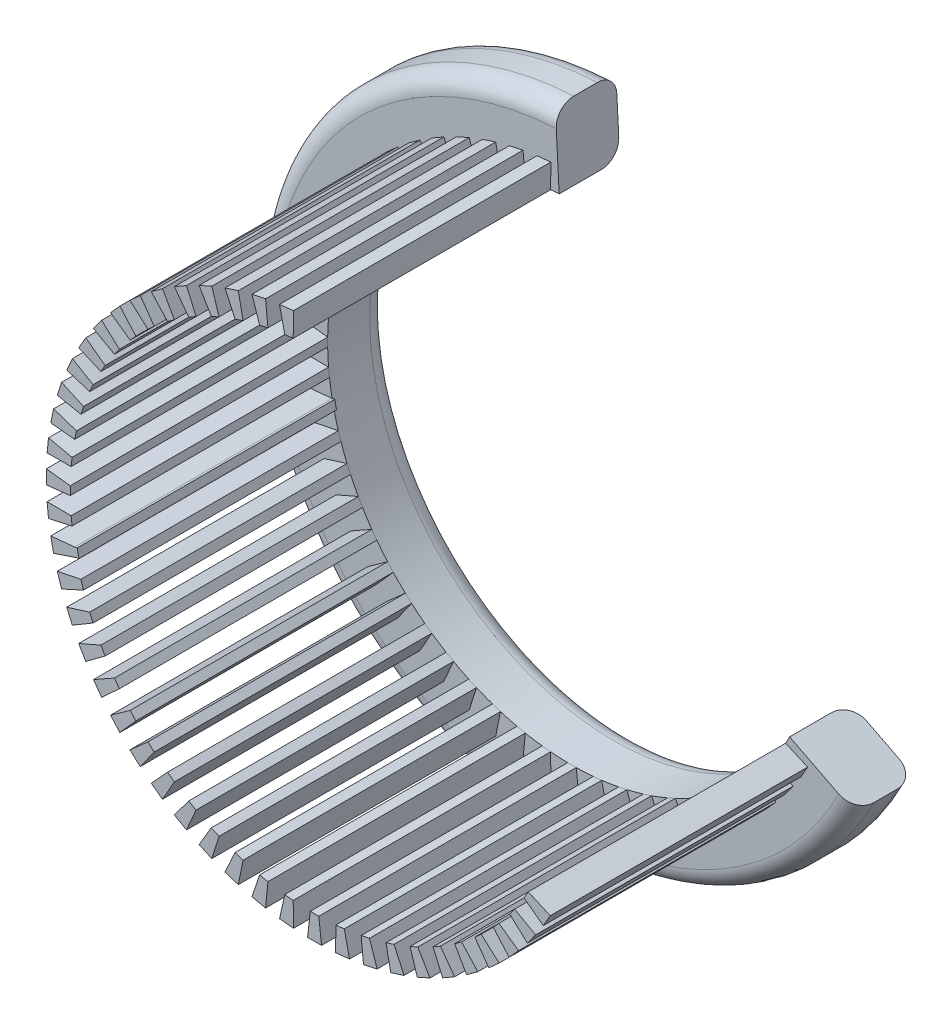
SolidWorks part; units mm, degrees
ref_plane "Přední rovina" through (0, 0, 0) normal (0, 0, 1) x (1, 0, 0)
ref_plane "Horní rovina" through (0, 0, 0) normal (0, 1, 0) x (1, 0, 0)
ref_plane "Pravá rovina" through (0, 0, 0) normal (1, 0, 0) x (0, 0, -1)
sketch "Skica1" plane through (0, 0, 0) normal (0, 0, 1) x (1, 0, 0)
  line L0 (0.0049, 148.7514) -> (0.0049, -162.0328) construction
  line L1 (-203.1858, -0.0001) -> (251.9227, -0.0001) construction
  line L2 (1.4, 79.8) -> (1.4, 78.4875)
  line L3 (0.0049, 78.3462) -> (0.0049, 88.5562)
  line L4 (-2.2951, 88.5562) -> (2.3049, 88.5562)
  line L5 (0.0049, 88.5562) -> (0.0049, 80.6562)
  line L6 (-1.3951, 80.6562) -> (1.4049, 80.6562)
  line L7 (0.0049, 80.6562) -> (0.0049, 80.0562)
  line L8 (7.0435, 80.3607) -> (9.8281, 80.068)
  line L9 (1.4, 79.8) -> (1.4049, 80.6562)
  line L10 (2.3049, 88.5562) -> (1.4049, 80.6562)
  line L11 (-1.3902, 79.8) -> (-1.3951, 80.6562)
  line L12 (-2.2951, 88.5562) -> (-1.3951, 80.6562)
  line L13 (6.9742, 88.3115) -> (7.0435, 80.3607)
  line L14 (6.9742, 88.3115) -> (11.549, 87.8307)
  line L15 (11.549, 87.8307) -> (9.8281, 80.068)
  line L16 (6.9588, 79.5087) -> (7.0435, 80.3607)
  line L17 (15.4049, 79.1848) -> (18.1437, 78.6026)
  line L18 (9.7337, 79.217) -> (9.8281, 80.068)
  line L19 (16.1671, 87.0993) -> (15.4049, 79.1848)
  line L20 (16.1671, 87.0993) -> (20.6665, 86.1429)
  line L21 (20.6665, 86.1429) -> (18.1437, 78.6026)
  line L22 (15.2317, 78.3462) -> (15.4049, 79.1848)
  line L23 (23.5976, 77.1413) -> (26.2606, 76.276)
  line L24 (17.9609, 77.7661) -> (18.1437, 78.6026)
  line L25 (25.1829, 84.9327) -> (23.5976, 77.1413)
  line L26 (25.1829, 84.9327) -> (29.5577, 83.5112)
  line L27 (29.5577, 83.5112) -> (26.2606, 76.276)
  line L28 (23.3377, 76.3254) -> (23.5976, 77.1413)
  line L29 (31.5318, 74.2526) -> (34.0897, 73.1137)
  line L30 (25.9913, 75.4632) -> (26.2606, 76.276)
  line L31 (33.9229, 81.8356) -> (31.5318, 74.2526)
  line L32 (33.9229, 81.8356) -> (38.1252, 79.9646)
  line L33 (38.1252, 79.9646) -> (34.0897, 73.1137)
  line L34 (31.188, 73.4684) -> (31.5318, 74.2526)
  line L35 (39.1206, 70.5503) -> (41.5455, 69.1503)
  line L36 (33.737, 72.3335) -> (34.0897, 73.1137)
  line L37 (42.2912, 77.8419) -> (39.1206, 70.5503)
  line L38 (42.2912, 77.8419) -> (46.2749, 75.5419)
  line L39 (46.2749, 75.5419) -> (41.5455, 69.1503)
  line L40 (38.6968, 69.8064) -> (39.1206, 70.5503)
  line L41 (46.2809, 66.0751) -> (48.5461, 64.4293)
  line L42 (41.1131, 68.4113) -> (41.5455, 69.1503)
  line L43 (50.1963, 72.9954) -> (46.2809, 66.0751)
  line L44 (50.1963, 72.9954) -> (53.9177, 70.2916)
  line L45 (53.9177, 70.2916) -> (48.5461, 64.4293)
  line L46 (45.7816, 65.3796) -> (46.2809, 66.0751)
  line L47 (52.9341, 60.876) -> (55.0149, 59.0025)
  line L48 (48.0389, 63.7395) -> (48.5461, 64.4293)
  line L49 (57.5514, 67.3491) -> (52.9341, 60.876)
  line L50 (57.5514, 67.3491) -> (60.9699, 64.2711)
  line L51 (60.9699, 64.2711) -> (55.0149, 59.0025)
  line L52 (52.3648, 60.2364) -> (52.9341, 60.876)
  line L53 (59.0074, 55.0099) -> (60.881, 52.9291)
  line L54 (54.4383, 58.3694) -> (55.0149, 59.0025)
  line L55 (64.2761, 60.9649) -> (59.0074, 55.0099)
  line L56 (64.2761, 60.9649) -> (67.3541, 57.5464)
  line L57 (67.3541, 57.5464) -> (60.881, 52.9291)
  line L58 (58.3744, 54.4334) -> (59.0074, 55.0099)
  line L59 (64.4343, 48.5411) -> (66.0801, 46.2759)
  line L60 (60.2414, 52.3598) -> (60.881, 52.9291)
  line L61 (70.2966, 53.9128) -> (64.4343, 48.5411)
  line L62 (70.2966, 53.9128) -> (73.0004, 50.1913)
  line L63 (73.0004, 50.1913) -> (66.0801, 46.2759)
  line L64 (63.7445, 48.0339) -> (64.4343, 48.5411)
  line L65 (69.1553, 41.5405) -> (70.5553, 39.1156)
  line L66 (65.3845, 45.7766) -> (66.0801, 46.2759)
  line L67 (75.5469, 46.2699) -> (69.1553, 41.5405)
  line L68 (75.5469, 46.2699) -> (77.8469, 42.2862)
  line L69 (77.8469, 42.2862) -> (70.5553, 39.1156)
  line L70 (68.4163, 41.1081) -> (69.1553, 41.5405)
  line L71 (73.1187, 34.0848) -> (74.2576, 31.5268)
  line L72 (69.8114, 38.6918) -> (70.5553, 39.1156)
  line L73 (79.9696, 38.1202) -> (73.1187, 34.0848)
  line L74 (79.9696, 38.1202) -> (81.8406, 33.9179)
  line L75 (81.8406, 33.9179) -> (74.2576, 31.5268)
  line L76 (72.3385, 33.732) -> (73.1187, 34.0848)
  line L77 (76.281, 26.2556) -> (77.1462, 23.5926)
  line L78 (73.4733, 31.183) -> (74.2576, 31.5268)
  line L79 (83.5162, 29.5528) -> (76.281, 26.2556)
  line L80 (83.5162, 29.5528) -> (84.9377, 25.1779)
  line L81 (84.9377, 25.1779) -> (77.1462, 23.5926)
  line L82 (75.4682, 25.9863) -> (76.281, 26.2556)
  line L83 (78.6076, 18.1387) -> (79.1898, 15.3999)
  line L84 (76.3304, 23.3327) -> (77.1462, 23.5926)
  line L85 (86.1479, 20.6615) -> (78.6076, 18.1387)
  line L86 (86.1479, 20.6615) -> (87.1043, 16.1621)
  line L87 (87.1043, 16.1621) -> (79.1898, 15.3999)
  line L88 (77.7711, 17.9559) -> (78.6076, 18.1387)
  line L89 (80.073, 9.8231) -> (80.3657, 7.0385)
  line L90 (78.3512, 15.2267) -> (79.1898, 15.3999)
  line L91 (87.8357, 11.544) -> (80.073, 9.8231)
  line L92 (87.8357, 11.544) -> (88.3165, 6.9692)
  line L93 (88.3165, 6.9692) -> (80.3657, 7.0385)
  line L94 (79.222, 9.7287) -> (80.073, 9.8231)
  line L95 (80.6612, 1.3999) -> (80.6612, -1.4001)
  line L96 (79.5137, 6.9538) -> (80.3657, 7.0385)
  line L97 (88.5612, 2.2999) -> (80.6612, 1.3999)
  line L98 (88.5612, 2.2999) -> (88.5612, -2.3001)
  line L99 (88.5612, -2.3001) -> (80.6612, -1.4001)
  line L100 (79.805, 1.395) -> (80.6612, 1.3999)
  line L101 (80.3657, -7.0386) -> (80.073, -9.8233)
  line L102 (79.805, -1.3952) -> (80.6612, -1.4001)
  line L103 (88.3165, -6.9693) -> (80.3657, -7.0386)
  line L104 (88.3165, -6.9693) -> (87.8357, -11.5441)
  line L105 (87.8357, -11.5441) -> (80.073, -9.8233)
  line L106 (79.5137, -6.954) -> (80.3657, -7.0386)
  line L107 (79.1898, -15.4001) -> (78.6076, -18.1389)
  line L108 (79.222, -9.7289) -> (80.073, -9.8233)
  line L109 (87.1043, -16.1622) -> (79.1898, -15.4001)
  line L110 (87.1043, -16.1622) -> (86.1479, -20.6617)
  line L111 (86.1479, -20.6617) -> (78.6076, -18.1389)
  line L112 (78.3512, -15.2268) -> (79.1898, -15.4001)
  line L113 (77.1462, -23.5928) -> (76.281, -26.2557)
  line L114 (77.7711, -17.9561) -> (78.6076, -18.1389)
  line L115 (84.9377, -25.1781) -> (77.1462, -23.5928)
  line L116 (84.9377, -25.1781) -> (83.5162, -29.5529)
  line L117 (83.5162, -29.5529) -> (76.281, -26.2557)
  line L118 (76.3304, -23.3329) -> (77.1462, -23.5928)
  line L119 (74.2576, -31.527) -> (73.1187, -34.0849)
  line L120 (75.4682, -25.9865) -> (76.281, -26.2557)
  line L121 (81.8406, -33.918) -> (74.2576, -31.527)
  line L122 (81.8406, -33.918) -> (79.9696, -38.1203)
  line L123 (79.9696, -38.1203) -> (73.1187, -34.0849)
  line L124 (73.4733, -31.1832) -> (74.2576, -31.527)
  line L125 (70.5553, -39.1158) -> (69.1553, -41.5407)
  line L126 (72.3385, -33.7322) -> (73.1187, -34.0849)
  line L127 (77.8469, -42.2864) -> (70.5553, -39.1158)
  line L128 (77.8469, -42.2864) -> (75.5469, -46.2701)
  line L129 (75.5469, -46.2701) -> (69.1553, -41.5407)
  line L130 (69.8114, -38.6919) -> (70.5553, -39.1158)
  line L131 (66.0801, -46.2761) -> (64.4343, -48.5413)
  line L132 (68.4163, -41.1083) -> (69.1553, -41.5407)
  line L133 (73.0004, -50.1914) -> (66.0801, -46.2761)
  line L134 (73.0004, -50.1914) -> (70.2966, -53.9129)
  line L135 (70.2966, -53.9129) -> (64.4343, -48.5413)
  line L136 (65.3845, -45.7767) -> (66.0801, -46.2761)
  line L137 (60.881, -52.9293) -> (59.0074, -55.0101)
  line L138 (63.7445, -48.0341) -> (64.4343, -48.5413)
  line L139 (67.3541, -57.5466) -> (60.881, -52.9293)
  line L140 (67.3541, -57.5466) -> (64.2761, -60.9651)
  line L141 (64.2761, -60.9651) -> (59.0074, -55.0101)
  line L142 (60.2414, -52.36) -> (60.881, -52.9293)
  line L143 (55.0149, -59.0026) -> (52.9341, -60.8762)
  line L144 (58.3744, -54.4335) -> (59.0074, -55.0101)
  line L145 (60.9699, -64.2713) -> (55.0149, -59.0026)
  line L146 (60.9699, -64.2713) -> (57.5514, -67.3493)
  line L147 (57.5514, -67.3493) -> (52.9341, -60.8762)
  line L148 (54.4383, -58.3696) -> (55.0149, -59.0026)
  line L149 (48.5461, -64.4295) -> (46.2809, -66.0753)
  line L150 (52.3648, -60.2366) -> (52.9341, -60.8762)
  line L151 (53.9177, -70.2917) -> (48.5461, -64.4295)
  line L152 (53.9177, -70.2917) -> (50.1963, -72.9956)
  line L153 (50.1963, -72.9956) -> (46.2809, -66.0753)
  line L154 (48.0389, -63.7397) -> (48.5461, -64.4295)
  line L155 (41.5455, -69.1505) -> (39.1206, -70.5505)
  line L156 (45.7816, -65.3797) -> (46.2809, -66.0753)
  line L157 (46.2749, -75.5421) -> (41.5455, -69.1505)
  line L158 (46.2749, -75.5421) -> (42.2912, -77.8421)
  line L159 (42.2912, -77.8421) -> (39.1206, -70.5505)
  line L160 (41.1131, -68.4114) -> (41.5455, -69.1505)
  line L161 (34.0897, -73.1139) -> (31.5318, -74.2527)
  line L162 (38.6968, -69.8065) -> (39.1206, -70.5505)
  line L163 (38.1252, -79.9648) -> (34.0897, -73.1139)
  line L164 (38.1252, -79.9648) -> (33.9229, -81.8358)
  line L165 (33.9229, -81.8358) -> (31.5318, -74.2527)
  line L166 (33.737, -72.3337) -> (34.0897, -73.1139)
  line L167 (26.2606, -76.2762) -> (23.5976, -77.1414)
  line L168 (31.188, -73.4685) -> (31.5318, -74.2527)
  line L169 (29.5577, -83.5114) -> (26.2606, -76.2762)
  line L170 (29.5577, -83.5114) -> (25.1829, -84.9329)
  line L171 (25.1829, -84.9329) -> (23.5976, -77.1414)
  line L172 (25.9913, -75.4634) -> (26.2606, -76.2762)
  line L173 (18.1437, -78.6028) -> (15.4049, -79.185)
  line L174 (23.3377, -76.3256) -> (23.5976, -77.1414)
  line L175 (20.6665, -86.143) -> (18.1437, -78.6028)
  line L176 (20.6665, -86.143) -> (16.1671, -87.0994)
  line L177 (16.1671, -87.0994) -> (15.4049, -79.185)
  line L178 (17.9609, -77.7663) -> (18.1437, -78.6028)
  line L179 (9.8281, -80.0682) -> (7.0435, -80.3609)
  line L180 (15.2317, -78.3464) -> (15.4049, -79.185)
  line L181 (11.549, -87.8309) -> (9.8281, -80.0682)
  line L182 (11.549, -87.8309) -> (6.9742, -88.3117)
  line L183 (6.9742, -88.3117) -> (7.0435, -80.3609)
  line L184 (9.7337, -79.2172) -> (9.8281, -80.0682)
  line L185 (1.4049, -80.6564) -> (-1.3951, -80.6564)
  line L186 (6.9588, -79.5088) -> (7.0435, -80.3609)
  line L187 (2.3049, -88.5564) -> (1.4049, -80.6564)
  line L188 (2.3049, -88.5564) -> (-2.2951, -88.5564)
  line L189 (-2.2951, -88.5564) -> (-1.3951, -80.6564)
  line L190 (1.4, -79.8002) -> (1.4049, -80.6564)
  line L191 (-7.0336, -80.3609) -> (-9.8183, -80.0682)
  line L192 (-1.3902, -79.8002) -> (-1.3951, -80.6564)
  line L193 (-6.9644, -88.3117) -> (-7.0336, -80.3609)
  line L194 (-6.9644, -88.3117) -> (-11.5392, -87.8309)
  line L195 (-11.5392, -87.8309) -> (-9.8183, -80.0682)
  line L196 (-6.949, -79.5088) -> (-7.0336, -80.3609)
  line L197 (-15.3951, -79.185) -> (-18.1339, -78.6028)
  line L198 (-9.7239, -79.2172) -> (-9.8183, -80.0682)
  line L199 (-16.1573, -87.0994) -> (-15.3951, -79.185)
  line L200 (-16.1573, -87.0994) -> (-20.6567, -86.143)
  line L201 (-20.6567, -86.143) -> (-18.1339, -78.6028)
  line L202 (-15.2219, -78.3464) -> (-15.3951, -79.185)
  line L203 (-23.5878, -77.1414) -> (-26.2507, -76.2762)
  line L204 (-17.9511, -77.7663) -> (-18.1339, -78.6028)
  line L205 (-25.1731, -84.9329) -> (-23.5878, -77.1414)
  line L206 (-25.1731, -84.9329) -> (-29.5479, -83.5114)
  line L207 (-29.5479, -83.5114) -> (-26.2507, -76.2762)
  line L208 (-23.3279, -76.3256) -> (-23.5878, -77.1414)
  line L209 (-31.522, -74.2527) -> (-34.0799, -73.1139)
  line L210 (-25.9815, -75.4634) -> (-26.2507, -76.2762)
  line L211 (-33.913, -81.8358) -> (-31.522, -74.2527)
  line L212 (-33.913, -81.8358) -> (-38.1154, -79.9648)
  line L213 (-38.1154, -79.9648) -> (-34.0799, -73.1139)
  line L214 (-31.1782, -73.4685) -> (-31.522, -74.2527)
  line L215 (-39.1108, -70.5505) -> (-41.5357, -69.1505)
  line L216 (-33.7272, -72.3337) -> (-34.0799, -73.1139)
  line L217 (-42.2814, -77.8421) -> (-39.1108, -70.5505)
  line L218 (-42.2814, -77.8421) -> (-46.2651, -75.5421)
  line L219 (-46.2651, -75.5421) -> (-41.5357, -69.1505)
  line L220 (-38.687, -69.8065) -> (-39.1108, -70.5505)
  line L221 (-46.2711, -66.0753) -> (-48.5363, -64.4295)
  line L222 (-41.1033, -68.4114) -> (-41.5357, -69.1505)
  line L223 (-50.1865, -72.9956) -> (-46.2711, -66.0753)
  line L224 (-50.1865, -72.9956) -> (-53.9079, -70.2917)
  line L225 (-53.9079, -70.2917) -> (-48.5363, -64.4295)
  line L226 (-45.7718, -65.3797) -> (-46.2711, -66.0753)
  line L227 (-45.7718, -65.3797) -> (-48.0291, -63.7397)
  line L228 (-48.0291, -63.7397) -> (-48.5363, -64.4295)
  line L229 (-57.5416, -67.3493) -> (-52.9243, -60.8762)
  line L230 (-57.5416, -67.3493) -> (-60.9601, -64.2713)
  line L231 (-60.9601, -64.2713) -> (-55.0051, -59.0026)
  line L232 (-52.355, -60.2366) -> (-52.9243, -60.8762)
  line L233 (-52.9243, -60.8762) -> (-55.0051, -59.0026)
  line L234 (-54.4285, -58.3696) -> (-55.0051, -59.0026)
  line L235 (-64.2663, -60.9651) -> (-58.9976, -55.0101)
  line L236 (-64.2663, -60.9651) -> (-67.3443, -57.5466)
  line L237 (-67.3443, -57.5466) -> (-60.8712, -52.9293)
  line L238 (-58.3646, -54.4335) -> (-58.9976, -55.0101)
  line L239 (-58.9976, -55.0101) -> (-60.8712, -52.9293)
  line L240 (-60.2316, -52.36) -> (-60.8712, -52.9293)
  line L241 (-70.2868, -53.9129) -> (-64.4245, -48.5413)
  line L242 (-70.2868, -53.9129) -> (-72.9906, -50.1914)
  line L243 (-72.9906, -50.1914) -> (-66.0703, -46.2761)
  line L244 (-63.7347, -48.0341) -> (-64.4245, -48.5413)
  line L245 (-64.4245, -48.5413) -> (-66.0703, -46.2761)
  line L246 (-65.3747, -45.7767) -> (-66.0703, -46.2761)
  line L247 (-75.5371, -46.2701) -> (-69.1455, -41.5407)
  line L248 (-75.5371, -46.2701) -> (-77.8371, -42.2864)
  line L249 (-77.8371, -42.2864) -> (-70.5455, -39.1158)
  line L250 (-68.4065, -41.1083) -> (-69.1455, -41.5407)
  line L251 (-69.1455, -41.5407) -> (-70.5455, -39.1158)
  line L252 (-69.8015, -38.6919) -> (-70.5455, -39.1158)
  line L253 (-79.9598, -38.1203) -> (-73.1089, -34.0849)
  line L254 (-79.9598, -38.1203) -> (-81.8308, -33.918)
  line L255 (-81.8308, -33.918) -> (-74.2477, -31.527)
  line L256 (-72.3287, -33.7322) -> (-73.1089, -34.0849)
  line L257 (-73.1089, -34.0849) -> (-74.2477, -31.527)
  line L258 (-73.4635, -31.1832) -> (-74.2477, -31.527)
  line L259 (-83.5064, -29.5529) -> (-76.2712, -26.2557)
  line L260 (-83.5064, -29.5529) -> (-84.9279, -25.1781)
  line L261 (-84.9279, -25.1781) -> (-77.1364, -23.5928)
  line L262 (-75.4584, -25.9865) -> (-76.2712, -26.2557)
  line L263 (-75.4584, -25.9865) -> (-76.3206, -23.3329)
  line L264 (-76.3206, -23.3329) -> (-77.1364, -23.5928)
  line L265 (-86.1381, -20.6617) -> (-78.5978, -18.1389)
  line L266 (-86.1381, -20.6617) -> (-87.0944, -16.1622)
  line L267 (-87.0944, -16.1622) -> (-79.18, -15.4001)
  line L268 (-77.7613, -17.9561) -> (-78.5978, -18.1389)
  line L269 (-77.7613, -17.9561) -> (-78.3414, -15.2268)
  line L270 (-78.3414, -15.2268) -> (-79.18, -15.4001)
  line L271 (-87.8259, -11.5441) -> (-80.0632, -9.8233)
  line L272 (-87.8259, -11.5441) -> (-88.3067, -6.9693)
  line L273 (-88.3067, -6.9693) -> (-80.3559, -7.0386)
  line L274 (-79.2122, -9.7289) -> (-80.0632, -9.8233)
  line L275 (-76.2712, -26.2557) -> (-77.1364, -23.5928)
  line L276 (-79.5039, -6.954) -> (-80.3559, -7.0386)
  line L277 (-88.5514, -2.3001) -> (-80.6514, -1.4001)
  line L278 (-88.5514, -2.3001) -> (-88.5514, 2.2999)
  line L279 (-88.5514, 2.2999) -> (-80.6514, 1.3999)
  line L280 (-79.7952, -1.3952) -> (-80.6514, -1.4001)
  line L281 (-78.5978, -18.1389) -> (-79.18, -15.4001)
  line L282 (-79.7952, 1.395) -> (-80.6514, 1.3999)
  line L283 (-88.3067, 6.9692) -> (-80.3559, 7.0385)
  line L284 (-88.3067, 6.9692) -> (-87.8259, 11.544)
  line L285 (-87.8259, 11.544) -> (-80.0632, 9.8231)
  line L286 (-79.5039, 6.9538) -> (-80.3559, 7.0385)
  line L287 (-80.0632, -9.8233) -> (-80.3559, -7.0386)
  line L288 (-79.2122, 9.7287) -> (-80.0632, 9.8231)
  line L289 (-87.0944, 16.1621) -> (-79.18, 15.3999)
  line L290 (-87.0944, 16.1621) -> (-86.1381, 20.6615)
  line L291 (-86.1381, 20.6615) -> (-78.5978, 18.1387)
  line L292 (-78.3414, 15.2267) -> (-79.18, 15.3999)
  line L293 (-80.6514, -1.4001) -> (-80.6514, 1.3999)
  line L294 (-77.7613, 17.9559) -> (-78.5978, 18.1387)
  line L295 (-84.9279, 25.1779) -> (-77.1364, 23.5926)
  line L296 (-84.9279, 25.1779) -> (-83.5064, 29.5528)
  line L297 (-83.5064, 29.5528) -> (-76.2712, 26.2556)
  line L298 (-76.3206, 23.3327) -> (-77.1364, 23.5926)
  line L299 (-80.3559, 7.0385) -> (-80.0632, 9.8231)
  line L300 (-75.4584, 25.9863) -> (-76.2712, 26.2556)
  line L301 (-81.8308, 33.9179) -> (-74.2477, 31.5268)
  line L302 (-81.8308, 33.9179) -> (-79.9598, 38.1202)
  line L303 (-79.9598, 38.1202) -> (-73.1089, 34.0848)
  line L304 (-73.4635, 31.183) -> (-74.2477, 31.5268)
  line L305 (-79.18, 15.3999) -> (-78.5978, 18.1387)
  line L306 (-72.3287, 33.732) -> (-73.1089, 34.0848)
  line L307 (-77.8371, 42.2862) -> (-70.5455, 39.1156)
  line L308 (-77.8371, 42.2862) -> (-75.5371, 46.2699)
  line L309 (-75.5371, 46.2699) -> (-69.1455, 41.5405)
  line L310 (-69.8015, 38.6918) -> (-70.5455, 39.1156)
  line L311 (-77.1364, 23.5926) -> (-76.2712, 26.2556)
  line L312 (-68.4065, 41.1081) -> (-69.1455, 41.5405)
  line L313 (-72.9906, 50.1913) -> (-66.0703, 46.2759)
  line L314 (-72.9906, 50.1913) -> (-70.2868, 53.9128)
  line L315 (-70.2868, 53.9128) -> (-64.4245, 48.5411)
  line L316 (-65.3747, 45.7766) -> (-66.0703, 46.2759)
  line L317 (-74.2477, 31.5268) -> (-73.1089, 34.0848)
  line L318 (-63.7347, 48.0339) -> (-64.4245, 48.5411)
  line L319 (-67.3443, 57.5464) -> (-60.8712, 52.9291)
  line L320 (-67.3443, 57.5464) -> (-64.2663, 60.9649)
  line L321 (-64.2663, 60.9649) -> (-58.9976, 55.0099)
  line L322 (-60.2316, 52.3598) -> (-60.8712, 52.9291)
  line L323 (-70.5455, 39.1156) -> (-69.1455, 41.5405)
  line L324 (-58.3646, 54.4334) -> (-58.9976, 55.0099)
  line L325 (-60.9601, 64.2711) -> (-55.0051, 59.0025)
  line L326 (-60.9601, 64.2711) -> (-57.5416, 67.3491)
  line L327 (-57.5416, 67.3491) -> (-52.9243, 60.876)
  line L328 (-54.4285, 58.3694) -> (-55.0051, 59.0025)
  line L329 (-66.0703, 46.2759) -> (-64.4245, 48.5411)
  line L330 (-52.355, 60.2364) -> (-52.9243, 60.876)
  line L331 (-53.9079, 70.2916) -> (-48.5363, 64.4293)
  line L332 (-53.9079, 70.2916) -> (-50.1865, 72.9954)
  line L333 (-50.1865, 72.9954) -> (-46.2711, 66.0751)
  line L334 (-48.0291, 63.7395) -> (-48.5363, 64.4293)
  line L335 (-60.8712, 52.9291) -> (-58.9976, 55.0099)
  line L336 (-45.7718, 65.3796) -> (-46.2711, 66.0751)
  line L337 (-46.2651, 75.5419) -> (-41.5357, 69.1503)
  line L338 (-46.2651, 75.5419) -> (-42.2814, 77.8419)
  line L339 (-42.2814, 77.8419) -> (-39.1108, 70.5503)
  line L340 (-41.1033, 68.4113) -> (-41.5357, 69.1503)
  line L341 (-55.0051, 59.0025) -> (-52.9243, 60.876)
  line L342 (-38.687, 69.8064) -> (-39.1108, 70.5503)
  line L343 (-38.1154, 79.9646) -> (-34.0799, 73.1137)
  line L344 (-38.1154, 79.9646) -> (-33.913, 81.8356)
  line L345 (-33.913, 81.8356) -> (-31.522, 74.2526)
  line L346 (-33.7272, 72.3335) -> (-34.0799, 73.1137)
  line L347 (-48.5363, 64.4293) -> (-46.2711, 66.0751)
  line L348 (-31.1782, 73.4684) -> (-31.522, 74.2526)
  line L349 (-29.5479, 83.5112) -> (-26.2507, 76.276)
  line L350 (-29.5479, 83.5112) -> (-25.1731, 84.9327)
  line L351 (-25.1731, 84.9327) -> (-23.5878, 77.1413)
  line L352 (-25.9815, 75.4632) -> (-26.2507, 76.276)
  line L353 (-41.5357, 69.1503) -> (-39.1108, 70.5503)
  line L354 (-23.3279, 76.3254) -> (-23.5878, 77.1413)
  line L355 (-20.6567, 86.1429) -> (-18.1339, 78.6026)
  line L356 (-20.6567, 86.1429) -> (-16.1573, 87.0993)
  line L357 (-16.1573, 87.0993) -> (-15.3951, 79.1848)
  line L358 (-17.9511, 77.7661) -> (-18.1339, 78.6026)
  line L359 (-34.0799, 73.1137) -> (-31.522, 74.2526)
  line L360 (-15.2219, 78.3462) -> (-15.3951, 79.1848)
  line L361 (-11.5392, 87.8307) -> (-9.8183, 80.068)
  line L362 (-11.5392, 87.8307) -> (-6.9644, 88.3115)
  line L363 (-6.9644, 88.3115) -> (-7.0336, 80.3607)
  line L364 (-9.7239, 79.217) -> (-9.8183, 80.068)
  line L365 (-26.2507, 76.276) -> (-23.5878, 77.1413)
  line L366 (-6.949, 79.5087) -> (-7.0336, 80.3607)
  line L367 (-1.3902, 79.8) -> (-1.3902, 78.4875)
  line L368 (6.9588, 79.5087) -> (6.8216, 78.2034)
  line L369 (9.7337, 79.217) -> (9.5965, 77.9117)
  line L370 (15.2317, 78.3462) -> (14.9588, 77.0624)
  line L371 (17.9609, 77.7661) -> (17.688, 76.4823)
  line L372 (23.3377, 76.3254) -> (22.9321, 75.0772)
  line L373 (25.9913, 75.4632) -> (25.5857, 74.215)
  line L374 (31.188, 73.4684) -> (30.6542, 72.2693)
  line L375 (33.737, 72.3335) -> (33.2032, 71.1345)
  line L376 (38.6968, 69.8064) -> (38.0405, 68.6697)
  line L377 (41.1131, 68.4113) -> (40.4569, 67.2746)
  line L378 (45.7816, 65.3796) -> (45.0101, 64.3177)
  line L379 (48.0389, 63.7395) -> (47.2674, 62.6777)
  line L380 (52.3648, 60.2364) -> (51.4866, 59.2611)
  line L381 (54.4383, 58.3694) -> (53.5601, 57.3941)
  line L382 (58.3744, 54.4334) -> (57.3991, 53.5551)
  line L383 (60.2414, 52.3598) -> (59.2661, 51.4816)
  line L384 (63.7445, 48.0339) -> (62.6827, 47.2624)
  line L385 (65.3845, 45.7766) -> (64.3227, 45.0051)
  line L386 (68.4163, 41.1081) -> (67.2796, 40.4519)
  line L387 (69.8114, 38.6918) -> (68.6747, 38.0355)
  line L388 (72.3385, 33.732) -> (71.1395, 33.1982)
  line L389 (73.4733, 31.183) -> (72.2743, 30.6492)
  line L390 (75.4682, 25.9863) -> (74.2199, 25.5807)
  line L391 (76.3304, 23.3327) -> (75.0822, 22.9271)
  line L392 (77.7711, 17.9559) -> (76.4873, 17.683)
  line L393 (78.3512, 15.2267) -> (77.0674, 14.9538)
  line L394 (79.222, 9.7287) -> (77.9167, 9.5916)
  line L395 (79.5137, 6.9538) -> (78.2084, 6.8166)
  line L396 (79.805, 1.395) -> (78.4925, 1.395)
  line L397 (79.805, -1.3952) -> (78.4925, -1.3952)
  line L398 (79.5137, -6.954) -> (78.2084, -6.8168)
  line L399 (79.222, -9.7289) -> (77.9167, -9.5917)
  line L400 (78.3512, -15.2268) -> (77.0674, -14.954)
  line L401 (77.7711, -17.9561) -> (76.4873, -17.6832)
  line L402 (76.3304, -23.3329) -> (75.0822, -22.9273)
  line L403 (75.4682, -25.9865) -> (74.2199, -25.5809)
  line L404 (73.4733, -31.1832) -> (72.2743, -30.6494)
  line L405 (72.3385, -33.7322) -> (71.1395, -33.1984)
  line L406 (69.8114, -38.6919) -> (68.6747, -38.0357)
  line L407 (68.4163, -41.1083) -> (67.2796, -40.4521)
  line L408 (65.3845, -45.7767) -> (64.3227, -45.0053)
  line L409 (63.7445, -48.0341) -> (62.6827, -47.2626)
  line L410 (60.2414, -52.36) -> (59.2661, -51.4818)
  line L411 (58.3744, -54.4335) -> (57.3991, -53.5553)
  line L412 (54.4383, -58.3696) -> (53.5601, -57.3942)
  line L413 (52.3648, -60.2366) -> (51.4866, -59.2612)
  line L414 (48.0389, -63.7397) -> (47.2674, -62.6779)
  line L415 (45.7816, -65.3797) -> (45.0101, -64.3179)
  line L416 (41.1131, -68.4114) -> (40.4569, -67.2748)
  line L417 (38.6968, -69.8065) -> (38.0405, -68.6699)
  line L418 (33.737, -72.3337) -> (33.2032, -71.1346)
  line L419 (31.188, -73.4685) -> (30.6542, -72.2695)
  line L420 (25.9913, -75.4634) -> (25.5857, -74.2151)
  line L421 (23.3377, -76.3256) -> (22.9321, -75.0773)
  line L422 (17.9609, -77.7663) -> (17.688, -76.4825)
  line L423 (15.2317, -78.3464) -> (14.9588, -77.0626)
  line L424 (9.7337, -79.2172) -> (9.5965, -77.9119)
  line L425 (6.9588, -79.5088) -> (6.8216, -78.2036)
  line L426 (1.4, -79.8002) -> (1.4, -78.4877)
  line L427 (-1.3902, -79.8002) -> (-1.3902, -78.4877)
  line L428 (-6.949, -79.5088) -> (-6.8118, -78.2036)
  line L429 (-9.7239, -79.2172) -> (-9.5867, -77.9119)
  line L430 (-15.2219, -78.3464) -> (-14.949, -77.0626)
  line L431 (-17.9511, -77.7663) -> (-17.6782, -76.4825)
  line L432 (-23.3279, -76.3256) -> (-22.9223, -75.0773)
  line L433 (-25.9815, -75.4634) -> (-25.5759, -74.2151)
  line L434 (-31.1782, -73.4685) -> (-30.6444, -72.2695)
  line L435 (-33.7272, -72.3337) -> (-33.1934, -71.1346)
  line L436 (-38.687, -69.8065) -> (-38.0307, -68.6699)
  line L437 (-41.1033, -68.4114) -> (-40.4471, -67.2748)
  line L438 (-45.7718, -65.3797) -> (-45.0003, -64.3179)
  line L439 (-48.0291, -63.7397) -> (-47.2576, -62.6779)
  line L440 (-52.355, -60.2366) -> (-51.4768, -59.2612)
  line L441 (-54.4285, -58.3696) -> (-53.5503, -57.3942)
  line L442 (-58.3646, -54.4335) -> (-57.3892, -53.5553)
  line L443 (-60.2316, -52.36) -> (-59.2563, -51.4818)
  line L444 (-63.7347, -48.0341) -> (-62.6729, -47.2626)
  line L445 (-65.3747, -45.7767) -> (-64.3129, -45.0053)
  line L446 (-68.4065, -41.1083) -> (-67.2698, -40.4521)
  line L447 (-69.8015, -38.6919) -> (-68.6649, -38.0357)
  line L448 (-72.3287, -33.7322) -> (-71.1297, -33.1984)
  line L449 (-73.4635, -31.1832) -> (-72.2645, -30.6494)
  line L450 (-75.4584, -25.9865) -> (-74.2101, -25.5809)
  line L451 (-76.3206, -23.3329) -> (-75.0723, -22.9273)
  line L452 (-77.7613, -17.9561) -> (-76.4775, -17.6832)
  line L453 (-78.3414, -15.2268) -> (-77.0576, -14.954)
  line L454 (-79.2122, -9.7289) -> (-77.9069, -9.5917)
  line L455 (-79.5039, -6.954) -> (-78.1986, -6.8168)
  line L456 (-79.7952, -1.3952) -> (-78.4827, -1.3952)
  line L457 (-79.7952, 1.395) -> (-78.4827, 1.395)
  line L458 (-79.5039, 6.9538) -> (-78.1986, 6.8166)
  line L459 (-79.2122, 9.7287) -> (-77.9069, 9.5916)
  line L460 (-78.3414, 15.2267) -> (-77.0576, 14.9538)
  line L461 (-77.7613, 17.9559) -> (-76.4775, 17.683)
  line L462 (-76.3206, 23.3327) -> (-75.0723, 22.9271)
  line L463 (-75.4584, 25.9863) -> (-74.2101, 25.5807)
  line L464 (-73.4635, 31.183) -> (-72.2645, 30.6492)
  line L465 (-72.3287, 33.732) -> (-71.1297, 33.1982)
  line L466 (-69.8015, 38.6918) -> (-68.6649, 38.0355)
  line L467 (-68.4065, 41.1081) -> (-67.2698, 40.4519)
  line L468 (-65.3747, 45.7766) -> (-64.3129, 45.0051)
  line L469 (-63.7347, 48.0339) -> (-62.6729, 47.2624)
  line L470 (-60.2316, 52.3598) -> (-59.2563, 51.4816)
  line L471 (-58.3646, 54.4334) -> (-57.3892, 53.5551)
  line L472 (-54.4285, 58.3694) -> (-53.5503, 57.3941)
  line L473 (-52.355, 60.2364) -> (-51.4768, 59.2611)
  line L474 (-48.0291, 63.7395) -> (-47.2576, 62.6777)
  line L475 (-45.7718, 65.3796) -> (-45.0003, 64.3177)
  line L476 (-41.1033, 68.4113) -> (-40.4471, 67.2746)
  line L477 (-38.687, 69.8064) -> (-38.0307, 68.6697)
  line L478 (-33.7272, 72.3335) -> (-33.1934, 71.1345)
  line L479 (-31.1782, 73.4684) -> (-30.6444, 72.2693)
  line L480 (-25.9815, 75.4632) -> (-25.5759, 74.215)
  line L481 (-23.3279, 76.3254) -> (-22.9223, 75.0772)
  line L482 (-17.9511, 77.7661) -> (-17.6782, 76.4823)
  line L483 (-15.2219, 78.3462) -> (-14.949, 77.0624)
  line L484 (-9.7239, 79.217) -> (-9.5867, 77.9117)
  line L485 (-6.949, 79.5087) -> (-6.8118, 78.2034)
  line L486 (-18.1339, 78.6026) -> (-15.3951, 79.1848)
  line L487 (-9.8183, 80.068) -> (-7.0336, 80.3607)
  arc A0 (-1.3902, 78.4875) -> (-6.8118, 78.2034) centre (0.0049, -0.0001) ccw
  circle A1 centre (0.0049, -0.0001) radius 127
  arc A2 (-9.5867, 77.9117) -> (-14.949, 77.0624) centre (0.0049, -0.0001) ccw
  arc A3 (-17.6782, 76.4823) -> (-22.9223, 75.0772) centre (0.0049, -0.0001) ccw
  arc A4 (-25.5759, 74.215) -> (-30.6444, 72.2693) centre (0.0049, -0.0001) ccw
  arc A5 (6.8216, 78.2034) -> (1.4, 78.4875) centre (0.0049, -0.0001) ccw
  arc A6 (14.9588, 77.0624) -> (9.5965, 77.9117) centre (0.0049, -0.0001) ccw
  arc A7 (-33.1934, 71.1345) -> (-38.0307, 68.6697) centre (0.0049, -0.0001) ccw
  arc A8 (-40.4471, 67.2746) -> (-45.0003, 64.3177) centre (0.0049, -0.0001) ccw
  arc A9 (-47.2576, 62.6777) -> (-51.4768, 59.2611) centre (0.0049, -0.0001) ccw
  arc A10 (-53.5503, 57.3941) -> (-57.3892, 53.5551) centre (0.0049, -0.0001) ccw
  arc A11 (-59.2563, 51.4816) -> (-62.6729, 47.2624) centre (0.0049, -0.0001) ccw
  arc A12 (-64.3129, 45.0051) -> (-67.2698, 40.4519) centre (0.0049, -0.0001) ccw
  arc A13 (-68.6649, 38.0355) -> (-71.1297, 33.1982) centre (0.0049, -0.0001) ccw
  arc A14 (-72.2645, 30.6492) -> (-74.2101, 25.5807) centre (0.0049, -0.0001) ccw
  arc A15 (-75.0723, 22.9271) -> (-76.4775, 17.683) centre (0.0049, -0.0001) ccw
  arc A16 (-77.0576, 14.9538) -> (-77.9069, 9.5916) centre (0.0049, -0.0001) ccw
  arc A17 (-78.1986, 6.8166) -> (-78.4827, 1.395) centre (0.0049, -0.0001) ccw
  arc A18 (-78.4827, -1.3952) -> (-78.1986, -6.8168) centre (0.0049, -0.0001) ccw
  arc A19 (-77.9069, -9.5917) -> (-77.0576, -14.954) centre (0.0049, -0.0001) ccw
  arc A20 (-76.4775, -17.6832) -> (-75.0723, -22.9273) centre (0.0049, -0.0001) ccw
  arc A21 (-74.2101, -25.5809) -> (-72.2645, -30.6494) centre (0.0049, -0.0001) ccw
  arc A22 (-71.1297, -33.1984) -> (-68.6649, -38.0357) centre (0.0049, -0.0001) ccw
  arc A23 (-67.2698, -40.4521) -> (-64.3129, -45.0053) centre (0.0049, -0.0001) ccw
  arc A24 (-62.6729, -47.2626) -> (-59.2563, -51.4818) centre (0.0049, -0.0001) ccw
  arc A25 (-57.3892, -53.5553) -> (-53.5503, -57.3942) centre (0.0049, -0.0001) ccw
  arc A26 (-51.4768, -59.2612) -> (-47.2576, -62.6779) centre (0.0049, -0.0001) ccw
  arc A27 (-45.0003, -64.3179) -> (-40.4471, -67.2748) centre (0.0049, -0.0001) ccw
  arc A28 (-38.0307, -68.6699) -> (-33.1934, -71.1346) centre (0.0049, -0.0001) ccw
  arc A29 (-30.6444, -72.2695) -> (-25.5759, -74.2151) centre (0.0049, -0.0001) ccw
  arc A30 (-22.9223, -75.0773) -> (-17.6782, -76.4825) centre (0.0049, -0.0001) ccw
  arc A31 (-14.949, -77.0626) -> (-9.5867, -77.9119) centre (0.0049, -0.0001) ccw
  arc A32 (-6.8118, -78.2036) -> (-1.3902, -78.4877) centre (0.0049, -0.0001) ccw
  arc A33 (1.4, -78.4877) -> (6.8216, -78.2036) centre (0.0049, -0.0001) ccw
  arc A34 (9.5965, -77.9119) -> (14.9588, -77.0626) centre (0.0049, -0.0001) ccw
  arc A35 (17.688, -76.4825) -> (22.9321, -75.0773) centre (0.0049, -0.0001) ccw
  arc A36 (25.5857, -74.2151) -> (30.6542, -72.2695) centre (0.0049, -0.0001) ccw
  arc A37 (33.2032, -71.1346) -> (38.0405, -68.6699) centre (0.0049, -0.0001) ccw
  arc A38 (40.4569, -67.2748) -> (45.0101, -64.3179) centre (0.0049, -0.0001) ccw
  arc A39 (47.2674, -62.6779) -> (51.4866, -59.2612) centre (0.0049, -0.0001) ccw
  arc A40 (53.5601, -57.3942) -> (57.3991, -53.5553) centre (0.0049, -0.0001) ccw
  arc A41 (59.2661, -51.4818) -> (62.6827, -47.2626) centre (0.0049, -0.0001) ccw
  arc A42 (64.3227, -45.0053) -> (67.2796, -40.4521) centre (0.0049, -0.0001) ccw
  arc A43 (68.6747, -38.0357) -> (71.1395, -33.1984) centre (0.0049, -0.0001) ccw
  arc A44 (72.2743, -30.6494) -> (74.2199, -25.5809) centre (0.0049, -0.0001) ccw
  arc A45 (75.0822, -22.9273) -> (76.4873, -17.6832) centre (0.0049, -0.0001) ccw
  arc A46 (77.0674, -14.954) -> (77.9167, -9.5917) centre (0.0049, -0.0001) ccw
  arc A47 (78.2084, -6.8168) -> (78.4925, -1.3952) centre (0.0049, -0.0001) ccw
  arc A48 (78.4925, 1.395) -> (78.2084, 6.8166) centre (0.0049, -0.0001) ccw
  arc A49 (77.9167, 9.5916) -> (77.0674, 14.9538) centre (0.0049, -0.0001) ccw
  arc A50 (76.4873, 17.683) -> (75.0822, 22.9271) centre (0.0049, -0.0001) ccw
  arc A51 (74.2199, 25.5807) -> (72.2743, 30.6492) centre (0.0049, -0.0001) ccw
  arc A52 (71.1395, 33.1982) -> (68.6747, 38.0355) centre (0.0049, -0.0001) ccw
  arc A53 (67.2796, 40.4519) -> (64.3227, 45.0051) centre (0.0049, -0.0001) ccw
  arc A54 (62.6827, 47.2624) -> (59.2661, 51.4816) centre (0.0049, -0.0001) ccw
  arc A55 (22.9321, 75.0772) -> (17.688, 76.4823) centre (0.0049, -0.0001) ccw
  arc A56 (30.6542, 72.2693) -> (25.5857, 74.215) centre (0.0049, -0.0001) ccw
  arc A57 (38.0405, 68.6697) -> (33.2032, 71.1345) centre (0.0049, -0.0001) ccw
  arc A58 (45.0101, 64.3177) -> (40.4569, 67.2746) centre (0.0049, -0.0001) ccw
  arc A59 (51.4866, 59.2611) -> (47.2674, 62.6777) centre (0.0049, -0.0001) ccw
  arc A60 (57.3991, 53.5551) -> (53.5601, 57.3941) centre (0.0049, -0.0001) ccw
  point P375 (0.0049, -0.0001)
  point P612 (0.0049, -0.0001)
  point P620 (0.0049, -0.0001)
  dimension "D1" = 254
  dimension "D2" = 157
  dimension "D13" = 78.5
  dimension "D3" = 1.3125
  dimension "D4" = 10.21
  dimension "D5" = 2.3
  dimension "D6" = 7.9
  dimension "D7" = 1.4
  dimension "D8" = 0.6
  dimension "D9" = 60
  dimension "D11" = 2.8
  dimension "D14" = 88.5563
  dimension "D10" = 60
  dimension "D12" = 60
extrude "Přidat vysunutím1" add sketch "Skica1" along normal blind 85 contours L295 L311 L297 L296 | L301 L317 L303 L302 | L307 L323 L309 L308 | L313 L329 L315 L314 | L319 L335 L321 L320 | L325 L341 L327 L326 | L331 L347 L333 L332 | L337 L353 L339 L338 | L343 L359 L345 L344 | L349 L365 L351 L350 | L355 L486 L357 L356 | L361 L487 L363 L362 | L289 L305 L291 L290 | L283 L299 L285 L284 | L271 L287 L273 L272 | L259 L275 L261 L260 | L277 L293 L279 L278 | L253 L257 L255 L254 | L247 L251 L249 L248 | L241 L245 L243 L242 | L235 L239 L237 L236 | L229 L233 L231 L230 | L225 L224 L223 L221 | L219 L218 L217 L215 | L213 L212 L211 L209 | L207 L206 L205 L203 | L201 L200 L199 L197 | L195 L194 L193 L191 | L189 L188 L187 L185 | L183 L182 L181 L179 | L177 L176 L175 L173 | L171 L170 L169 L167 | L165 L164 L163 L161 | L159 L158 L157 L155 | L153 L152 L151 L149 | L147 L146 L145 L143 | L141 L140 L139 L137 | L135 L134 L133 L131 | L129 L128 L127 L125 | L123 L122 L121 L119 | L117 L116 L115 L113 | L111 L110 L109 L107 | L105 L104 L103 L101 | L99 L98 L97 L95 | L93 L92 L91 L89 | L87 L86 L85 L83 | L81 L80 L79 L77 | L75 L74 L73 L71 | L69 L68 L67 L65 | L63 L62 L61 L59 | L57 L56 L55 L53 | L51 L50 L49 L47 | L45 L44 L43 L41 | L39 L38 L37 L35 | L33 L32 L31 L29 | L27 L26 L25 L23 | L21 L20 L19 L17 | L15 L14 L13 L8 | L10 L4 L3 L6 | L4 L12 L6 L3 | L266 L267 L270 L269 L268 L265
sketch "Skica2" plane through (0, 0, 0) normal (0, 0, 1) x (1, 0, 0)
  circle A0 centre (0, 0) radius 80.669
  circle A1 centre (0, 0) radius 105
  dimension "D1" = 210
extrude "Přidat vysunutím2" add sketch "Skica2" against normal blind 20
sketch "Skica4" plane through (0, 0, -20) normal (0, 0, -1) x (-1, 0, 0)
  line L0 (0, 0) -> (-91.8691, 0) construction
  line L1 (-91.8691, 40.534) -> (-91.8691, -40.534) construction
  line L2 (-96.5, 27.4975) -> (-96.5, 12.4975) construction
  line L3 (-91.8691, -7.5) -> (-91.8691, -12.5) construction
  line L4 (-96.5, 27.4975) -> (-91.5, 27.4975)
  line L9 (-96.5, 27.4975) -> (-96.5, 12.4975)
  line L11 (-96.5, 12.4975) -> (-91.5, 12.4975)
  line L12 (-91.5, 27.4975) -> (-91.5, 12.4975)
  point P5 (-91.8691, 0)
  dimension "D2" = 91.5
  dimension "D1" = 5
  dimension "D3" = 15
  dimension "D4" = 96.5
  dimension "D5" = 27.5
  dimension "D6" = 12.4975
extrude "Přidat vysunutím3" add sketch "Skica4" along normal blind 60
sketch "Skica5" plane through (91.5, 0, 0) normal (-1, 0, 0) x (0, 0, 1)
  line L2 (-80, 19.9975) -> (-72.5, 19.9975) construction
  line L3 (-80, 12.4975) -> (-80, 27.4975) construction
  line L4 (-72.5, 27.4975) -> (-72.5, 12.4975)
  line L5 (-72.5, 27.4975) -> (-80, 27.4975)
  line L6 (-80, 27.4975) -> (-80, 12.4975)
  line L7 (-80, 12.4975) -> (-72.5, 12.4975)
  arc A0 (-72.5, 27.4975) -> (-72.5, 12.4975) centre (-72.5, 19.9975) ccw
  circle A1 centre (-72.5, 19.9975) radius 4
  dimension "D2" = 8
  dimension "D1" = 7.5
extrude "Odebrat vysunutím2" cut sketch "Skica5" against normal blind 80 contours A0 M3 M4 | A0 L6 M5 | L2 A1 L4 | A1 L2 L4 | L4 A1
pattern_linear "LinPole3" count 3 spacing 20 along (0, -1, 0) of "Přidat vysunutím3"
sketch "Skica8" plane through (91.5, 0, 0) normal (-1, 0, 0) x (0, 0, 1)
  line L0 (-80, 7.4975) -> (-20, 7.4975) construction
  line L1 (-80, -7.5025) -> (-80, 7.4975) construction
  line L2 (-80, -0.0025) -> (-72.5, -0.0025) construction
  line L4 (-72.5, 7.4975) -> (-72.5, -7.5025)
  line L5 (-72.5, 7.4975) -> (-80, 7.4975)
  line L6 (-80, 7.4975) -> (-80, -7.5025)
  line L7 (-80, -7.5025) -> (-72.5, -7.5025)
  arc A0 (-72.5, 7.4975) -> (-72.5, -7.5025) centre (-72.5, -0.0025) ccw
  circle A1 centre (-72.5, -0.0025) radius 4
  dimension "D2" = 8
  dimension "D1" = 7.5
sketch "Skica9" plane through (91.5, 0, 0) normal (-1, 0, 0) x (0, 0, 1)
  line L0 (-80, -12.5025) -> (-20, -12.5025) construction
  line L1 (-80, -27.5025) -> (-80, -12.5025) construction
  line L2 (-80, -20.0025) -> (-72.5, -20.0025) construction
  line L4 (-72.5, -12.5025) -> (-72.5, -27.5025)
  line L5 (-72.5, -12.5025) -> (-80, -12.5025)
  line L6 (-80, -12.5025) -> (-80, -27.5025)
  line L7 (-80, -27.5025) -> (-72.5, -27.5025)
  arc A0 (-72.5, -12.5025) -> (-72.5, -27.5025) centre (-72.5, -20.0025) ccw
  circle A1 centre (-72.5, -20.0025) radius 4
  dimension "D2" = 8
  dimension "D1" = 7.5
extrude "Odebrat vysunutím3" cut sketch "Skica8" against normal blind 80 contours A0 M14 M15 | A0 L6 M16 | A1 L2 L4 | L2 A1 L4 | L4 A1
extrude "Odebrat vysunutím4" cut sketch "Skica9" against normal blind 80 contours A0 M14 M15 | A0 L6 M16 | A1 L2 L4 | L4 A1 | L2 A1 L4
scale "Měřítko1" scale about origin uniform scaling yes scale factor 0.655
sketch "Skica10" plane through (0, 0, 0) normal (0, 0, 1) x (1, 0, 0)
  line L0 (0, 0) -> (-5.1544, 98.2616)
  line L1 (0, 0) -> (87.6742, -44.667)
  circle A0 centre (0, 0) radius 98.3966
  dimension "D1" = 120
extrude "Odebrat vysunutím5" cut sketch "Skica10" along normal through all and the other way through all contours L1 A0 L0
fillet "Zaoblit1" radius 4 3 edges at (-57.6778, -37.4603, 0) (-57.6778, -37.4603, -13.1) (-44.3125, -28.7798, -13.1)
